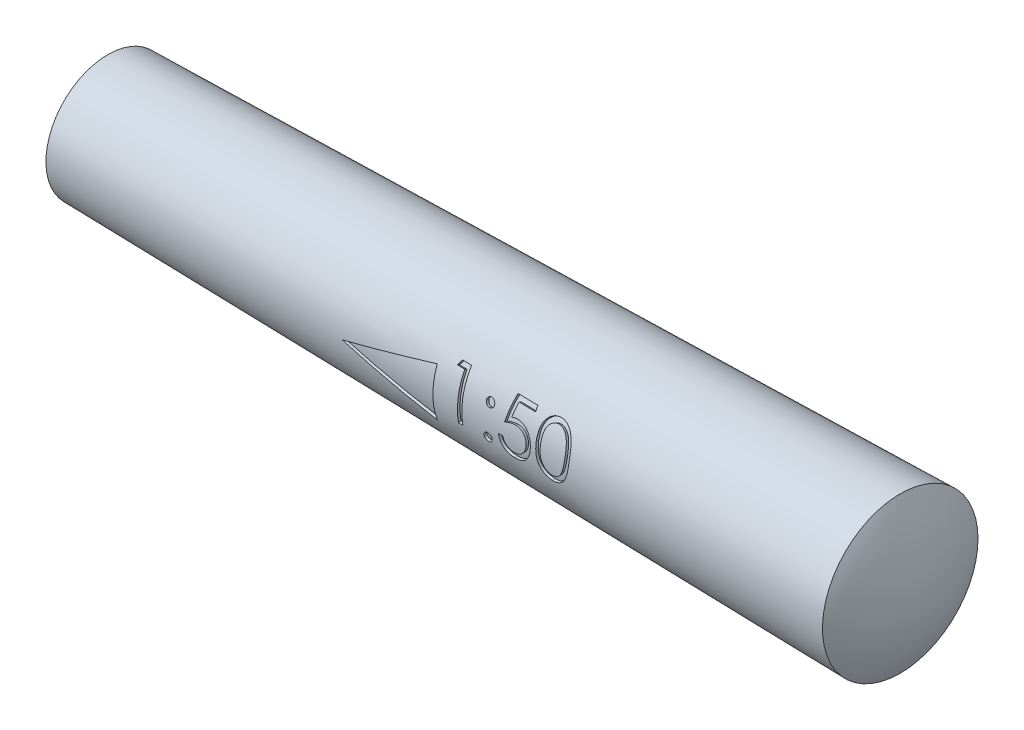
SolidWorks part; units mm, degrees
ref_plane "Front Plane" through (0, 0, 0) normal (0, 0, 1) x (1, 0, 0)
ref_plane "Top Plane" through (0, 0, 0) normal (0, 1, 0) x (1, 0, 0)
ref_plane "Right Plane" through (0, 0, 0) normal (1, 0, 0) x (0, 0, -1)
sketch "Sketch1" plane through (0, 0, 0) normal (1, 0, 0) x (0, 0, -1)
  circle A0 centre (0, 0) radius 1.25
  dimension "D1" = 2.5
extrude "Extrude1" add sketch "Sketch1" along normal mid plane 16
draft "Draft1" type of draft neutral plane draft angle 1.146 faces to draft 1 parameters "D1"=1.146
sketch "Sketch2" plane through (0, 0, 0) normal (0, 0, 1) x (1, 0, 0)
  line L0 (-8, 0) -> (-8, 1.25)
  line L1 (-8, 1.25) -> (-8, -1.25) construction
  line L2 (-8, 0) -> (-8.4, 0)
  line L3 (-8.4, 0) -> (-8.4, -1.41) construction
  line L4 (8, 0) -> (8, 1.57)
  line L5 (8, -1.57) -> (8, 1.57) construction
  line L6 (8, 0) -> (8.4, 0)
  line L7 (8.4, 0) -> (8.4, -1.41) construction
  line L8 (-8, -1.25) -> (8, -1.57) construction
  arc A0 (-8.4, 0) -> (-8, 1.25) centre (-6.2469, 0) cw
  arc A1 (8.4, 0) -> (8, 1.57) centre (5.1188, 0) ccw
  point P14 (0, -1.41)
revolve "Revolve1" add sketch "Sketch2" angle 360 about L2
sketch "Sketch5" plane through (0, 0, 0) normal (0, 0, 1) x (1, 0, 0)
  line L0 (0, 1.41) -> (0, -1.41) construction
  line L1 (8, 1.57) -> (-8, 1.25) construction
  line L2 (-8, -1.25) -> (8, -1.57) construction
ref_plane "Plane2" through (0, 0, 0) normal (-0.02, 0, 0.9998) x (0.9998, 0, 0.02)
sketch "Sketch6" plane through (0, 0, 0) normal (-0.02, 0, 0.9998) x (0.9998, 0, 0.02)
  line L0 (0, 0) -> (0, 0.5)
  line L1 (0, 1.41) -> (0, -1.41) construction
  line L2 (0, 0.5) -> (-1.866, 0)
  line L3 (-1.866, 0) -> (0, -0.5)
  line L4 (0, -0.5) -> (0, 0)
  line L5 (0, -0.25) -> (3, -0.25) construction
  text T0 "1:50" font "Century Gothic" height 1
  dimension "D1" = 1
  dimension "D2" = 30
  dimension "D3" = 3
wrap "Wrap2" sketch "Sketch6" wrap type deboss source sketch "Sketch6" thickness 0.05 parameters "D1"=0.05
equation "\"D2@Sketch2\" = \"D1@Sketch2\""
